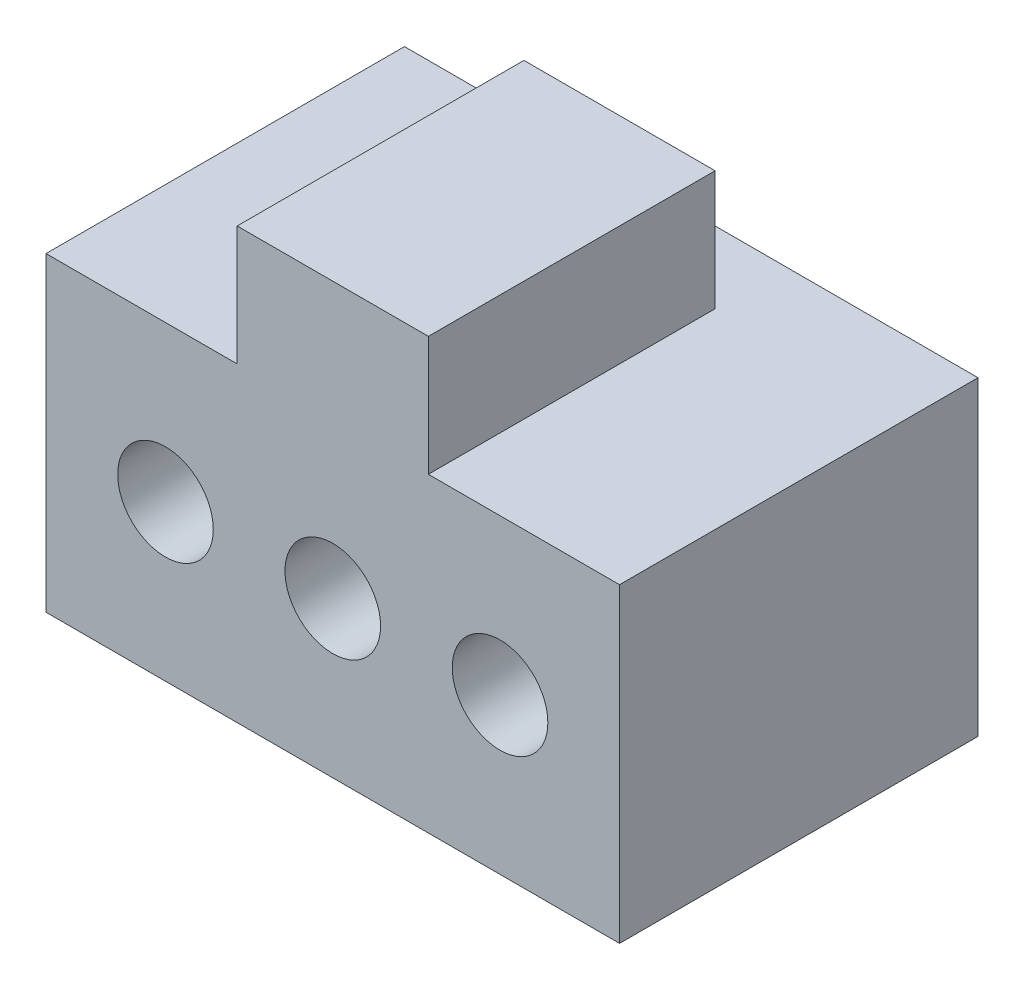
SolidWorks part; units mm, degrees
ref_plane "前视基准面" through (0, 0, 0) normal (0, 0, 1) x (1, 0, 0)
ref_plane "上视基准面" through (0, 0, 0) normal (0, 1, 0) x (1, 0, 0)
ref_plane "右视基准面" through (0, 0, 0) normal (1, 0, 0) x (0, 0, -1)
sketch "草图1" plane through (0, 0, 0) normal (0, 0, 1) x (1, 0, 0)
  line L0 (0, 0) -> (77.852, 0) construction
  line L1 (-60, 32.5) -> (60, 32.5)
  line L2 (-60, 32.5) -> (-60, -32.5)
  line L3 (-60, -32.5) -> (60, -32.5)
  line L4 (60, 32.5) -> (60, -32.5)
  line L5 (77.852, 0) -> (0, 0) construction
  line L6 (0, 0) -> (0, 66.2027) construction
extrude "拉伸1" add sketch "草图1" against normal blind 75
sketch "草图2" plane through (0, 0, 0) normal (0, 0, 1) x (1, 0, 0)
  line L0 (0, 0) -> (0, 68.5241) construction
  line L1 (60, 32.5) -> (-60, 32.5) construction
  line L2 (-20, 57.5) -> (20, 57.5)
  line L3 (-20, 57.5) -> (-20, 32.5)
  line L4 (-20, 32.5) -> (20, 32.5)
  line L5 (20, 57.5) -> (20, 32.5)
extrude "拉伸2" add sketch "草图2" against normal blind 60
sketch "草图3" plane through (0, 0, 0) normal (0, 0, 1) x (1, 0, 0)
  circle A0 centre (0, 0) radius 10
  circle A1 centre (35, 0) radius 10
  circle A2 centre (-35, 0) radius 10
extrude "切除-拉伸1" cut sketch "草图3" against normal through all
